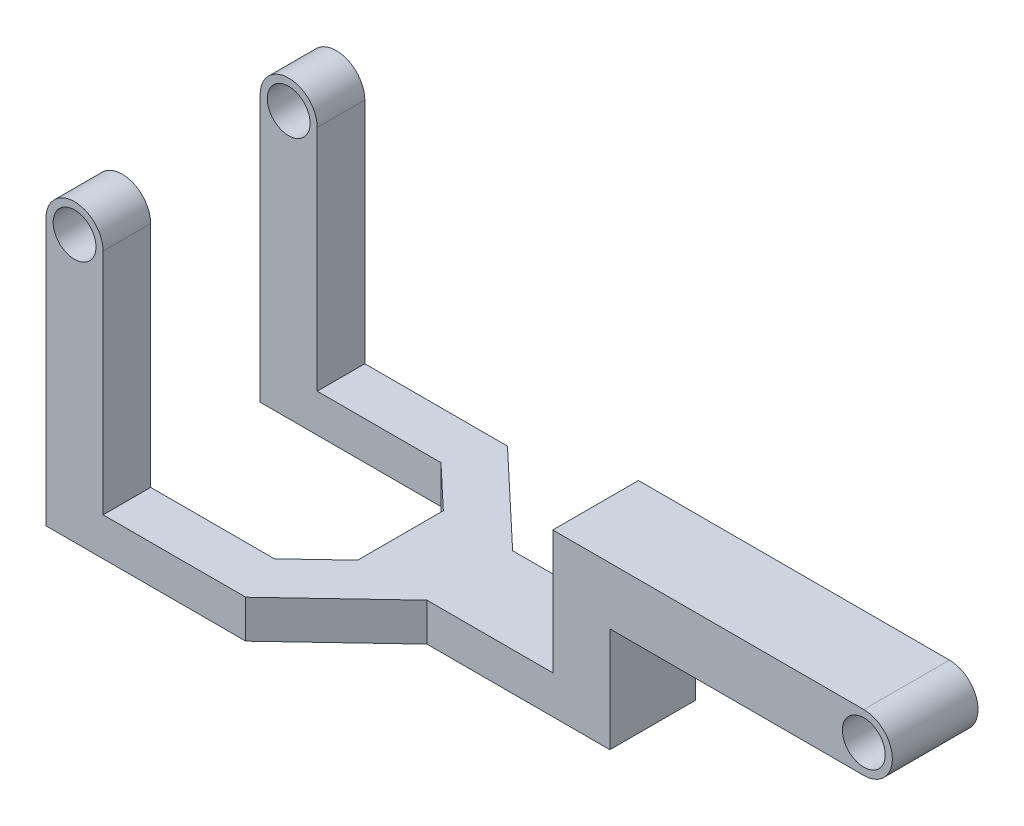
SolidWorks part; units mm, degrees
ref_plane "Plan de face" through (0, 0, 0) normal (0, 0, 1) x (1, 0, 0)
ref_plane "Plan de dessus" through (0, 0, 0) normal (0, 1, 0) x (1, 0, 0)
ref_plane "Plan de droite" through (0, 0, 0) normal (1, 0, 0) x (0, 0, -1)
sketch "Esquisse1" plane through (0, 0, 0) normal (0, 0, 1) x (1, 0, 0)
  line L0 (0, 280) -> (0, 0)
  line L1 (0, 0) -> (500, 0)
  line L2 (500, 0) -> (500, 110)
  line L4 (440, 40) -> (440, 170)
  line L5 (440, 40) -> (60, 40)
  line L6 (60, 40) -> (60, 280)
  line L7 (440, 170) -> (766.8, 170)
  line L9 (766.8, 110) -> (500, 110)
  circle A0 centre (30, 280) radius 22.5
  arc A1 (60, 280) -> (0, 280) centre (30, 280) ccw
  circle A2 centre (766.8, 140) radius 22.5
  arc A5 (766.8, 110) -> (766.8, 170) centre (766.8, 140) ccw
  dimension "D1" = 60
  dimension "D2" = 40
  dimension "D3" = 280
  dimension "D4" = 7.5
  dimension "D5" = 326.8
  dimension "D6" = 110
  dimension "D8" = 45
  dimension "D11" = 60
  dimension "D9" = 45
  dimension "D7" = 500
  dimension "D10" = 60
extrude "Boss.-Extru.1" add sketch "Esquisse1" along normal blind 275
sketch "Esquisse2" plane through (0, 40, 0) normal (0, 1, 0) x (1, 0, 0)
  line L0 (0, -50) -> (190, -50)
  line L1 (209.8789, 0) -> (307.8201, -92.5)
  line L2 (209.8789, 0) -> (909.8789, 0)
  line L3 (909.8789, -182.5) -> (909.8789, -275)
  line L4 (909.8789, -275) -> (209.8789, -275)
  line L5 (0, -225) -> (190, -225)
  line L6 (909.8789, -92.5) -> (307.8201, -92.5)
  line L7 (909.8789, -92.5) -> (909.8789, 0)
  line L8 (235, -92.5) -> (235, -182.5)
  line L9 (0, -50) -> (0, -225)
  line L10 (307.8201, -182.5) -> (909.8789, -182.5)
  line L11 (190, -50) -> (235, -92.5)
  line L12 (190, -225) -> (235, -182.5)
  line L13 (307.8201, -182.5) -> (209.8789, -275)
  line L14 (0, -275) -> (0, 0) construction
  line L17 (440, 0) -> (60, 0) construction
  dimension "D1" = 90
  dimension "D2" = 190
  dimension "D3" = 90
  dimension "D4" = 45
  dimension "D5" = 50
  dimension "D6" = 700
  dimension "D7" = 92.5
  dimension "D8" = 92.5
  dimension "D9" = 50
extrude "Enlèv. mat.-Extru.1" cut sketch "Esquisse2" against normal blind 275 and the other way blind 275
